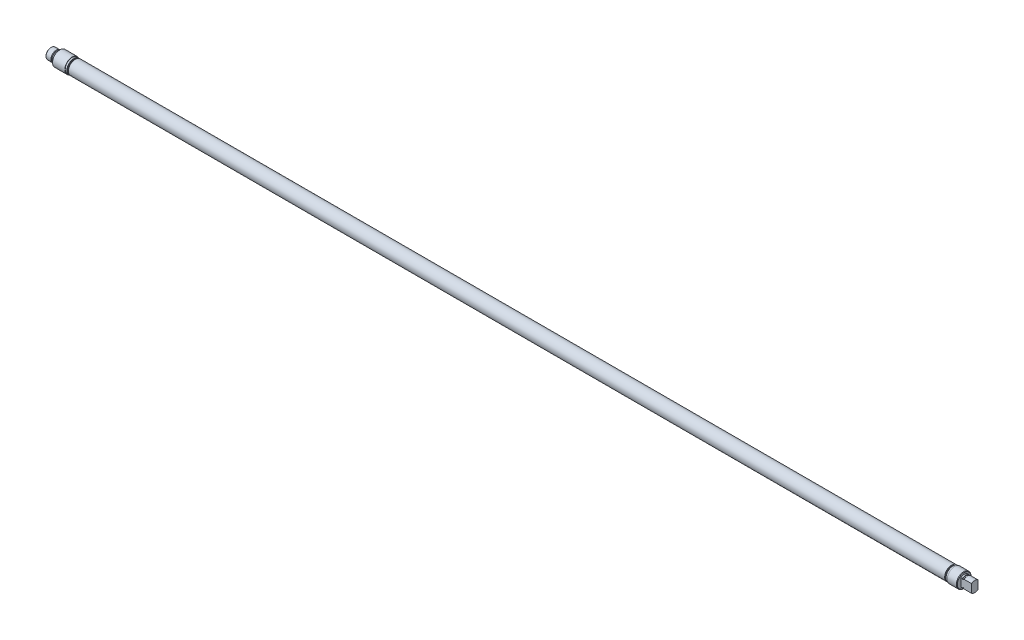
SolidWorks part; units mm, degrees
ref_plane "Front" through (0, 0, 0) normal (0, 0, 1) x (1, 0, 0)
ref_plane "Top" through (0, 0, 0) normal (0, 1, 0) x (1, 0, 0)
ref_plane "Right" through (0, 0, 0) normal (1, 0, 0) x (0, 0, -1)
sketch "Sketch2" plane through (0, 0, 0) normal (0, 0, 1) x (1, 0, 0)
  line L0 (1345.565, 10.287) -> (31.75, 10.287)
  line L1 (0, 7.9121) -> (8.0899, 7.9121)
  line L2 (0, 7.9121) -> (0, 0)
  line L3 (12.7, 10.922) -> (12.7, 7.9121)
  line L4 (1345.565, 10.922) -> (1345.565, 10.287)
  line L5 (1359.789, 50) -> (1359.789, -50) construction
  line L6 (0, 0) -> (1375.537, 0)
  line L7 (1359.789, 7.9121) -> (1359.789, 10.922)
  line L8 (-21.4174, 0) -> (42.4438, 0) construction
  line L9 (1345.565, 10.922) -> (1359.789, 10.922)
  line L10 (12.7, 10.922) -> (31.75, 10.922)
  line L11 (31.75, 10.922) -> (31.75, 10.287)
  line L12 (10.414, 7.9121) -> (10.414, 7.62)
  line L13 (9.906, 7.112) -> (9.1004, 7.112)
  line L14 (8.7412, 7.2608) -> (8.0899, 7.9121)
  line L15 (10.414, 7.9121) -> (12.7, 7.9121)
  line L16 (1359.789, 7.9121) -> (1362.075, 7.9121)
  line L17 (50, 0) -> (-50, 0) construction
  line L18 (1359.789, 10.287) -> (1359.789, -10.287) construction
  line L19 (12.7, 50) -> (12.7, -50) construction
  line L20 (1375.537, 7.9121) -> (1375.537, 0)
  line L21 (1362.075, 7.9121) -> (1362.075, 7.112)
  line L22 (1362.075, 7.112) -> (1363.599, 7.112)
  line L23 (1363.599, 7.112) -> (1364.3991, 7.9121)
  line L24 (1364.3991, 7.9121) -> (1375.537, 7.9121)
  arc A0 (9.1004, 7.112) -> (8.7412, 7.2608) centre (9.1004, 7.62) cw
  arc A1 (10.414, 7.62) -> (9.906, 7.112) centre (9.906, 7.62) cw
  point P26 (8.89, 7.112)
  point P30 (10.414, 7.112)
  dimension "D10" = 0.508
  dimension "D1" = 15.8242
  dimension "D2" = 12.7
  dimension "D3" = 14.224
  dimension "D4" = 21.844
  dimension "D5" = 31.75
  dimension "D6" = 1.524
  dimension "D7" = 2.286
  dimension "D8" = 14.224
  dimension "D9" = 45
  dimension "D11" = 2.286
  dimension "D12" = 1.524
  dimension "D13" = 45
  dimension "D14" = 15.748
revolve "Base-Revolve" add sketch "Sketch2" angle 360 about L8
sketch "Sketch3" plane through (0, 0, 0) normal (0, 0, 1) x (1, 0, 0)
  line L0 (34.29, 10.287) -> (34.29, 9.398)
  line L1 (34.29, 9.398) -> (35.179, 10.287)
  line L2 (35.179, 10.287) -> (34.29, 10.287)
  line L4 (35.56, 10.287) -> (35.56, 9.398)
  line L5 (35.56, 9.398) -> (36.449, 10.287)
  line L6 (36.449, 10.287) -> (35.56, 10.287)
  line L9 (31.75, -10.922) -> (31.75, 10.922) construction
  line L15 (0, 0) -> (35.6608, 0) construction
  line L16 (50, 0) -> (-50, 0) construction
  circle A0 centre (34.925, 9.398) radius 0.635 construction
  dimension "D4" = 20.574
  dimension "D1" = 1.27
  dimension "D2" = 0.889
  dimension "D3" = 2.54
revolve "Cut-Revolve1" cut sketch "Sketch3" angle 360 about L15
sketch "Sketch6" plane through (0, 0, 0) normal (0, 0, 1) x (1, 0, 0)
  line L0 (0, 0) -> (-63.9853, 0) construction
  line L1 (12.7, 0) -> (1359.789, 0) construction
  line L2 (1327.5945, 0) -> (1327.5945, 9.525)
  line L3 (1327.5945, 9.525) -> (44.8945, 9.525)
  line L4 (44.8945, 9.525) -> (44.8945, 3.175)
  line L5 (44.8945, 3.175) -> (0, 3.175)
  line L6 (0, 3.175) -> (0, 0)
  line L7 (0, 0) -> (1327.5945, 0)
  line L8 (1327.5945, 10.287) -> (1327.5945, -10.287) construction
  line L10 (44.8945, 10.287) -> (44.8945, -10.287) construction
  line L11 (50, 0) -> (-50, 0) construction
  line L12 (0, 7.9121) -> (0, -7.9121) construction
  dimension "D1" = 6.35
  dimension "D2" = 19.05
revolve "Cut-Revolve2" cut sketch "Sketch6" angle 360 about L0
sketch "Sketch13" plane through (0, 0, 0) normal (0, 0, 1) x (1, 0, 0)
  line L0 (-4.5831, 0) -> (1375.537, 0) construction
  line L2 (1340.993, 10.287) -> (1341.755, 10.287)
  line L3 (1341.755, 10.287) -> (1341.755, 9.525)
  line L4 (1340.993, 10.287) -> (1341.755, 9.525)
  line L5 (1342.263, 10.287) -> (1343.025, 10.287)
  line L6 (1343.025, 10.287) -> (1343.025, 9.525)
  line L7 (1342.263, 10.287) -> (1343.025, 9.525)
  line L8 (1345.565, 10.922) -> (1345.565, -10.922) construction
  line L9 (1375.537, -7.9121) -> (1375.537, 7.9121) construction
  dimension "D1" = 0.762
  dimension "D2" = 1.27
  dimension "D3" = 2.54
  dimension "D4" = 20.574
revolve "Cut-Revolve5" cut sketch "Sketch13" angle 360 about L0
ref_plane "Plane1" through (22.225, 10.922, 0) normal (0, 1, 0) x (0, 0, -1)
sketch "Sketch14" plane through (0, 0, 0) normal (0, 1, 0) x (1, 0, 0)
  line L0 (1359.789, -10.922) -> (1359.789, 10.922) construction
  line L1 (1375.537, 7.9121) -> (1359.789, 7.9121)
  line L2 (1375.537, 7.9121) -> (1375.537, 4.826)
  line L3 (1375.537, 4.826) -> (1359.789, 4.826)
  line L4 (1359.789, 7.9121) -> (1359.789, 4.826)
  line L5 (1359.789, -7.9121) -> (1359.789, 7.9121) construction
  line L6 (1375.537, -7.9121) -> (1359.789, -7.9121)
  line L7 (1375.537, -7.9121) -> (1375.537, -4.826)
  line L8 (1375.537, -4.826) -> (1359.789, -4.826)
  line L9 (1359.789, -7.9121) -> (1359.789, -4.826)
  line L10 (163.4408, 0) -> (103.8566, 0) construction
  dimension "D1" = 9.652
extrude "Cut-Extrude1" cut sketch "Sketch14" against normal through all and the other way through all
chamfer "Chamfer1" distance 0.762 angle 45 3 edges at (0, 0, 7.9121) (1359.789, 0, 10.922) (12.7, 0, 10.922)
